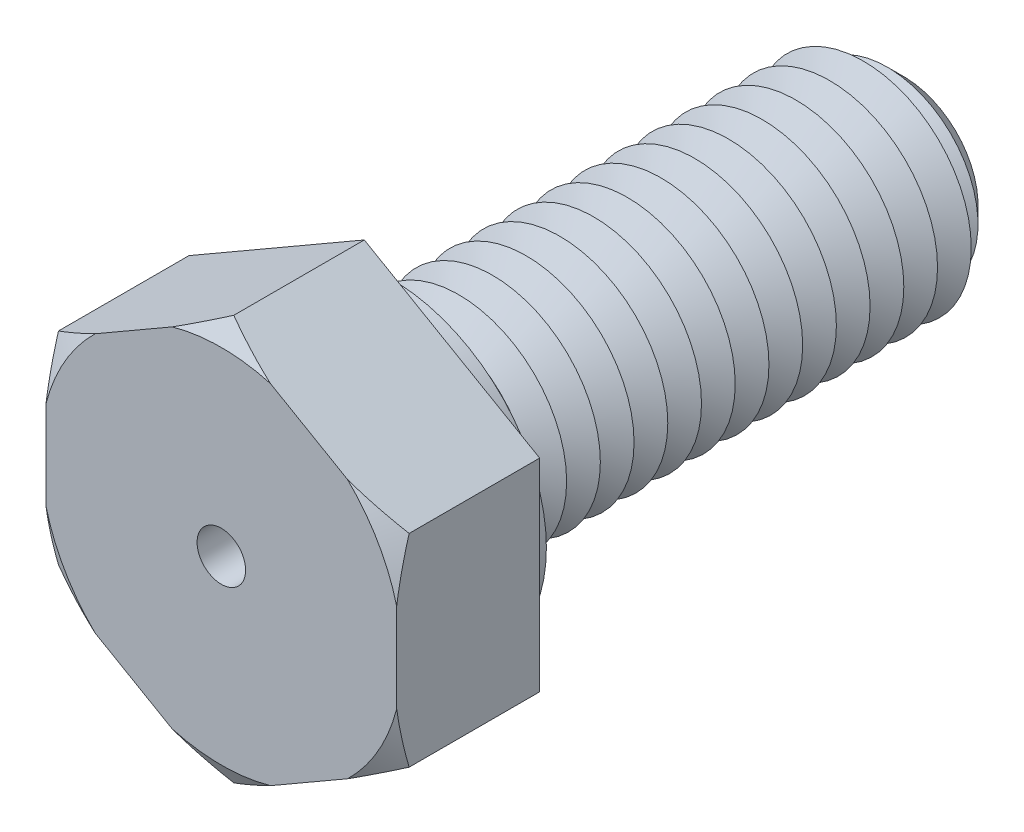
SolidWorks part; units mm, degrees
ref_plane "Front Plane" through (0, 0, 0) normal (0, 0, 1) x (1, 0, 0)
ref_plane "Top Plane" through (0, 0, 0) normal (0, 1, 0) x (1, 0, 0)
ref_plane "Right Plane" through (0, 0, 0) normal (1, 0, 0) x (0, 0, -1)
sketch "Sketch2" plane through (0, 0, 0) normal (0, 0, 1) x (1, 0, 0)
  line L1 (0, 7.5056) -> (-6.5, 3.7528)
  line L2 (-6.5, 3.7528) -> (-6.5, -3.7528)
  line L3 (-6.5, -3.7528) -> (0, -7.5056)
  line L4 (0, -7.5056) -> (6.5, -3.7528)
  line L5 (6.5, -3.7528) -> (6.5, 3.7528)
  line L6 (6.5, 3.7528) -> (0, 7.5056)
  circle A0 centre (0, 0) radius 6.5 construction
  dimension "D1" = 13
extrude "Boss-Extrude1" add sketch "Sketch2" along normal blind 5.3
sketch "Sketch3" plane through (0, 0, 0) normal (0, 0, -1) x (-1, 0, 0)
  circle A0 centre (0, 0) radius 4
  dimension "D1" = 8
extrude "Boss-Extrude2" add sketch "Sketch3" along normal blind 20
sketch "Sketch4" plane through (0, 0, 0) normal (0, 0, -1) x (-1, 0, 0)
  circle A0 centre (0, 0) radius 5.75
  dimension "D1" = 11.5
extrude "Boss-Extrude3" add sketch "Sketch4" along normal blind 1
sketch "Sketch5" plane through (0, 0, 0) normal (1, 0, 0) x (0, 0, -1)
  line L0 (-3.2117, 0) -> (6.3192, 0) construction
chamfer "Chamfer1" distance 1.25 angle 45 1 edges at (-4, 0, -20)
sketch "Sketch6" plane through (0, 0, 0) normal (1, 0, 0) x (0, 0, -1)
  line L0 (1, 4) -> (1.625, 2.9175)
  line L1 (1.625, 2.9175) -> (2.25, 4)
  line L2 (18.75, 4) -> (1, 4) construction
  line L3 (2.25, 4) -> (1, 4)
  dimension "D1" = 1.25
revolve "Cut-Revolve1" cut sketch "Sketch6" angle 360 about L0
pattern_linear "LPattern1" count 15 spacing 1.25 along (0, 0, -1) of "Cut-Revolve1"
sketch "Sketch7" plane through (0, 0, 0) normal (1, 0, 0) x (0, 0, -1)
  line L0 (-5.3, 7.5056) -> (-5.3, 6.7056)
  line L1 (-5.3, 3.7528) -> (-5.3, 7.5056) construction
  line L2 (-5.3, 6.7056) -> (-4.8381, 7.5056)
  line L3 (-5.3, 7.5056) -> (0, 7.5056) construction
  line L4 (-4.8381, 7.5056) -> (-5.3, 7.5056)
  dimension "D1" = 0.8
  dimension "D2" = 30
revolve "Cut-Revolve2" cut sketch "Sketch7" angle 360 about L0
sketch "Sketch8" plane through (0, 0, 5.3) normal (0, 0, 1) x (1, 0, 0)
  circle A0 centre (0, 0) radius 0.9
  dimension "D1" = 1.8
extrude "Cut-Extrude1" cut sketch "Sketch8" against normal up to surface (25.3 mm away)
